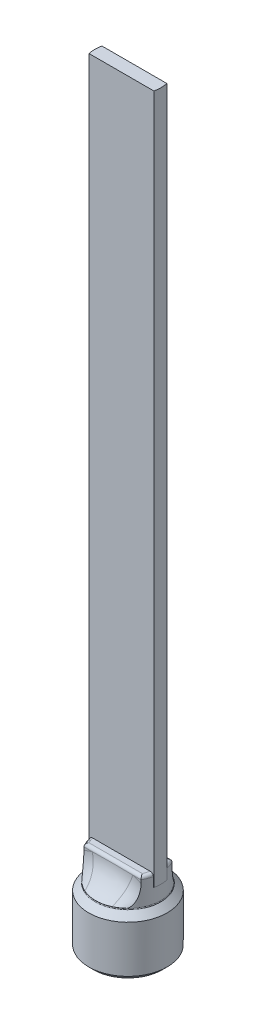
SolidWorks part; units mm, degrees
ref_plane "Front Plane" through (0, 0, 0) normal (0, 0, 1) x (1, 0, 0)
ref_plane "Top Plane" through (0, 0, 0) normal (0, 1, 0) x (1, 0, 0)
ref_plane "Right Plane" through (0, 0, 0) normal (1, 0, 0) x (0, 0, -1)
imported_body "Imported1"
sketch "Sketch1" plane through (0, 12.2428, 0) normal (0, 1, 0) x (1, 0, 0)
  line L0 (-5.4051, 1.0795) -> (5.4051, 1.0795)
  line L1 (5.4051, -1.0795) -> (-5.4051, -1.0795)
  line L2 (5.3014, 1.0795) -> (-5.3014, 1.0795) construction
  line L3 (-5.3014, -1.0795) -> (5.3014, -1.0795) construction
  arc A0 (5.4051, -1.0795) -> (5.4051, 1.0795) centre (0, 0) ccw
  arc A1 (-5.4051, 1.0795) -> (-5.4051, -1.0795) centre (0, 0) ccw
  dimension "D1" = 11.0236
extrude "Boss-Extrude1" add sketch "Sketch1" along normal offset from surface (114.7572 mm away) 127
